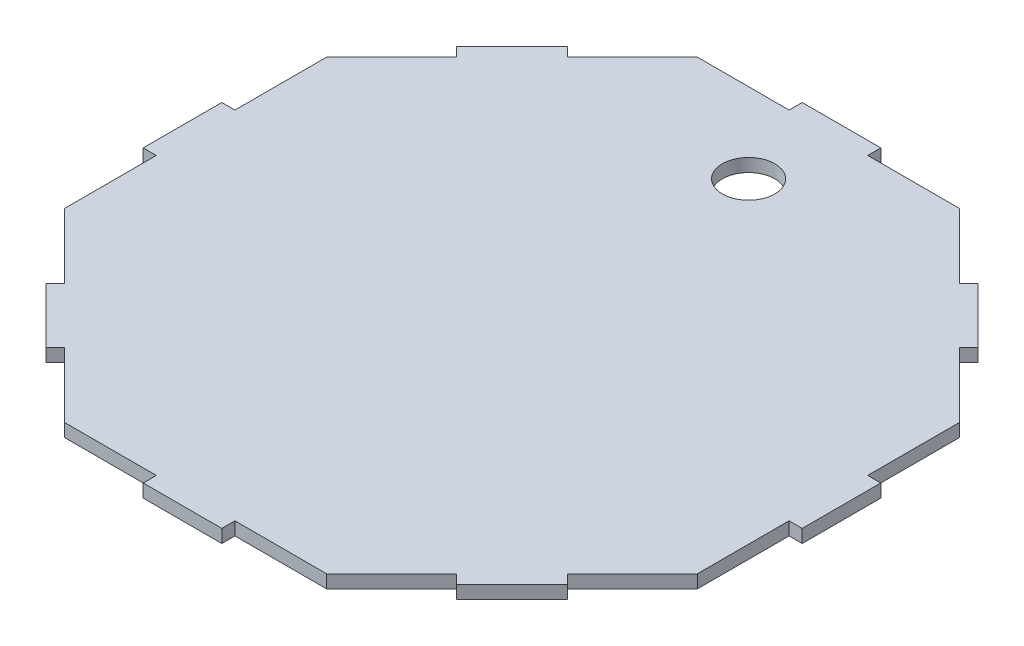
SolidWorks part; units mm, degrees
ref_plane "Alzado" through (0, 0, 0) normal (0, 0, 1) x (1, 0, 0)
ref_plane "Planta" through (0, 0, 0) normal (0, 1, 0) x (1, 0, 0)
ref_plane "Vista lateral" through (0, 0, 0) normal (1, 0, 0) x (0, 0, -1)
sketch "Croquis1" plane through (0, 0, 0) normal (0, 1, 0) x (1, 0, 0)
  line L0 (-30.909, -85.6617) -> (-30.909, -50.6617)
  line L1 (-30.909, 14.3383) -> (-6.1602, 39.087)
  line L2 (39.8017, 85.049) -> (74.8017, 85.049)
  line L3 (139.8017, 85.049) -> (164.5504, 60.3002)
  line L4 (210.5124, 14.3383) -> (210.5124, -20.6617)
  line L5 (210.5124, -85.6617) -> (185.7636, -110.4105)
  line L6 (139.8017, -156.3724) -> (104.8017, -156.3724)
  line L7 (39.8017, -156.3724) -> (15.053, -131.6237)
  line L16 (-35.909, -50.6617) -> (-35.909, -20.6617)
  line L21 (-9.6958, 42.6225) -> (11.5174, 63.8358)
  line L22 (74.8017, 90.049) -> (104.8017, 90.049)
  line L23 (168.086, 63.8358) -> (189.2992, 42.6225)
  line L24 (189.2992, -113.946) -> (168.086, -135.1592)
  line L25 (104.8017, -161.3724) -> (74.8017, -161.3724)
  line L26 (11.5174, -135.1592) -> (-9.6958, -113.946)
  line L27 (215.5124, -20.6617) -> (215.5124, -50.6617)
  line L28 (15.053, 60.3002) -> (39.8017, 85.049)
  line L29 (-30.909, -85.6617) -> (-23.8379, -85.6617)
  line L30 (-35.909, 16.4093) -> (37.7306, 90.049) construction
  line L31 (37.7306, 90.049) -> (141.8728, 90.049) construction
  line L32 (-30.909, -20.6617) -> (-30.909, 14.3383)
  line L33 (164.5504, -131.6237) -> (139.8017, -156.3724)
  line L34 (-30.909, 14.3383) -> (39.8017, 85.049) construction
  line L35 (139.8017, -156.3724) -> (139.292, -155.9055)
  line L36 (-35.909, -85.6617) -> (-35.909, 16.4093) construction
  line L37 (104.8017, 85.049) -> (139.8017, 85.049)
  line L38 (189.2992, -113.946) -> (185.7636, -110.4105)
  line L39 (-9.6958, 42.6225) -> (-6.1602, 39.087)
  line L40 (210.5124, -50.6617) -> (210.5124, -85.6617)
  line L41 (168.086, 63.8358) -> (164.5504, 60.3002)
  line L42 (-35.909, -50.6617) -> (-30.909, -50.6617)
  line L43 (189.2992, 42.6225) -> (185.7636, 39.087)
  line L44 (-35.909, -20.6617) -> (-30.909, -20.6617)
  line L45 (-30.909, -85.6617) -> (-30.909, 14.3383) construction
  line L46 (185.7636, 39.087) -> (210.5124, 14.3383)
  line L47 (39.8017, 85.049) -> (139.8017, 85.049) construction
  line L48 (141.8728, 90.049) -> (214.0479, 17.8738) construction
  line L49 (-30.909, -50.6617) -> (210.5124, -50.6617) construction
  line L50 (-6.1602, -110.4105) -> (-30.909, -85.6617)
  line L51 (15.053, 60.3002) -> (11.5174, 63.8358)
  line L52 (139.8017, 85.049) -> (210.5124, 14.3383) construction
  line L53 (-23.8379, -85.6617) -> (-30.909, -85.6617)
  line L54 (215.5124, 14.3383) -> (215.5124, -85.6617) construction
  line L55 (210.5124, 14.3383) -> (210.5124, -85.6617) construction
  line L56 (214.0479, -89.1973) -> (141.8728, -161.3724) construction
  line L57 (210.5124, -85.6617) -> (139.8017, -156.3724) construction
  line L58 (37.7306, -161.3724) -> (-34.4445, -89.1973) construction
  line L59 (74.8017, -156.3724) -> (39.8017, -156.3724)
  line L60 (-6.1602, -110.4105) -> (-9.6958, -113.946)
  line L61 (-30.909, -85.6617) -> (210.5124, -85.6617) construction
  line L62 (15.053, -131.6237) -> (11.5174, -135.1592)
  line L63 (164.5504, -131.6237) -> (168.086, -135.1592)
  line L64 (39.8017, -156.3724) -> (-30.909, -85.6617) construction
  line L65 (141.8728, -161.3724) -> (37.7306, -161.3724) construction
  line L67 (210.5124, -50.6617) -> (215.5124, -50.6617)
  line L68 (139.8017, -156.3724) -> (39.8017, -156.3724) construction
  line L69 (210.5124, -20.6617) -> (215.5124, -20.6617)
  line L73 (74.8017, -161.3724) -> (74.8017, -156.3724)
  line L74 (104.8017, 90.049) -> (104.8017, 85.049)
  line L77 (74.8017, 85.049) -> (74.8017, 90.049)
  line L79 (104.8017, -156.3724) -> (104.8017, -161.3724)
  circle A0 centre (89.8017, 54.5992) radius 10
  point P37 (210.5124, -20.6617)
  point P43 (185.7636, -110.4105)
  dimension "D1" = 135
  dimension "D2" = 135
  dimension "D3" = 135
  dimension "D4" = 135
  dimension "D6" = 135
  dimension "D8" = 100
  dimension "D10" = 100
  dimension "D11" = 100
  dimension "D12" = 5
  dimension "D22" = 35
extrude "Saliente-Extruir1" add sketch "Croquis1" along normal blind 5
